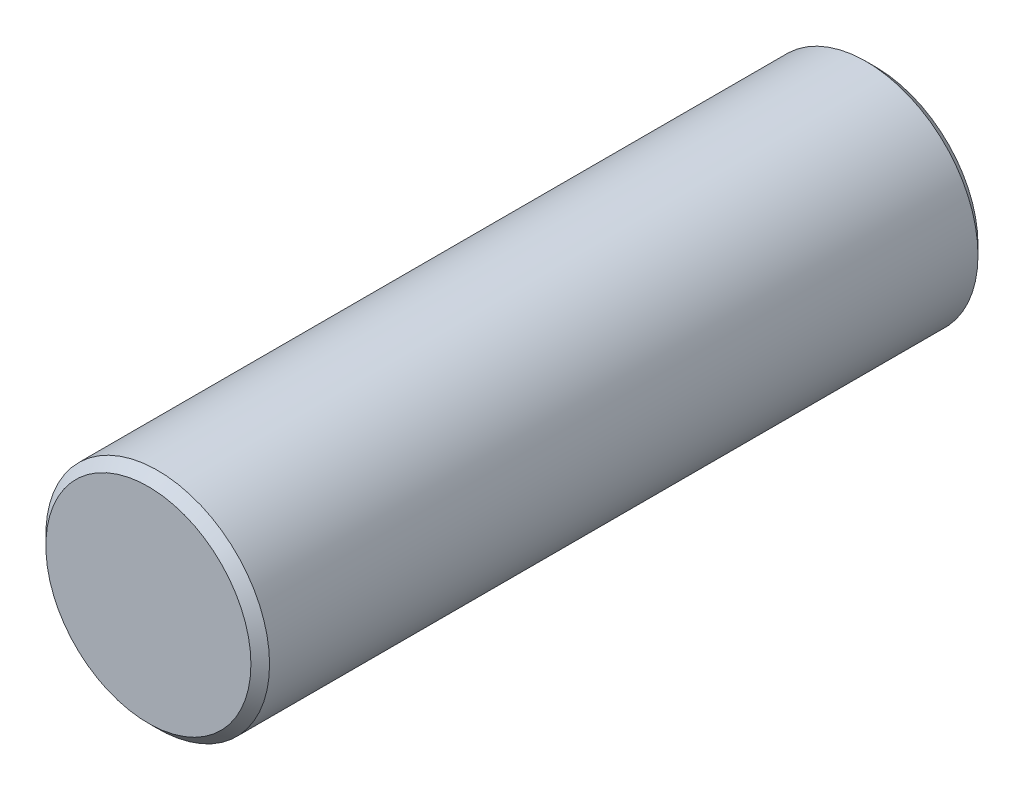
SolidWorks part; units mm, degrees
ref_plane "Plan1" through (0, 0, 0) normal (0, 0, 1) x (1, 0, 0)
ref_plane "Plan2" through (0, 0, 0) normal (0, 1, 0) x (1, 0, 0)
ref_plane "Plan3" through (0, 0, 0) normal (1, 0, 0) x (0, 0, -1)
sketch "Esquisse1" plane through (0, 0, 0) normal (0, 0, 1) x (1, 0, 0)
  circle A0 centre (-183.814, 43.4264) radius 6
  circle A1 centre (-183.814, 43.4264) radius 6 construction
extrude "cylindre" add sketch "Esquisse1" along normal mid plane 39
chamfer "Chanfrein1" distance 0.5 angle 45
